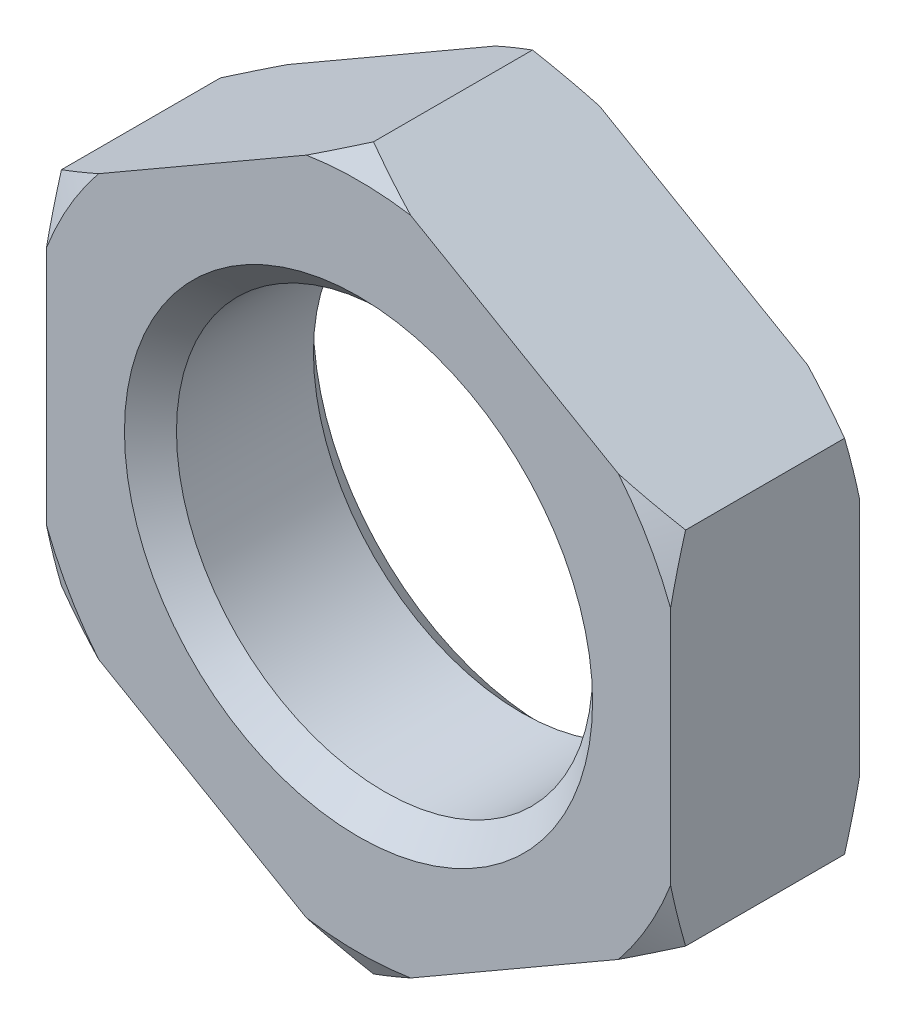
SolidWorks part; units mm, degrees
ref_plane "Front Plane" through (0, 0, 0) normal (0, 0, 1) x (1, 0, 0)
ref_plane "Top Plane" through (0, 0, 0) normal (0, 1, 0) x (1, 0, 0)
ref_plane "Right Plane" through (0, 0, 0) normal (1, 0, 0) x (0, 0, -1)
sketch "Sketch1" plane through (0, 0, 0) normal (0, 0, 1) x (1, 0, 0)
  line L1 (0, 20.7846) -> (-18, 10.3923)
  line L2 (-18, 10.3923) -> (-18, -10.3923)
  line L3 (-18, -10.3923) -> (0, -20.7846)
  line L4 (0, -20.7846) -> (18, -10.3923)
  line L5 (18, -10.3923) -> (18, 10.3923)
  line L6 (18, 10.3923) -> (0, 20.7846)
  circle A0 centre (0, 0) radius 18 construction
  circle A1 centre (0, 0) radius 12
  dimension "D2" = 24
  dimension "D1" = 36
extrude "Boss-Extrude1" add sketch "Sketch1" along normal mid plane 10.9
sketch "Sketch2" plane through (0, 0, 0) normal (1, 0, 0) x (0, 0, -1)
  line L0 (7.477, 0) -> (-8.5759, 0) construction
sketch "Sketch3" plane through (0, 0, 0) normal (1, 0, 0) x (0, 0, -1)
  line L0 (-5.45, 20.7846) -> (-5.45, 19.2846)
  line L1 (-5.45, 10.3923) -> (-5.45, 20.7846) construction
  line L2 (-5.45, 19.2846) -> (-4.584, 20.7846)
  line L3 (-5.45, 20.7846) -> (5.45, 20.7846) construction
  line L4 (-4.584, 20.7846) -> (-5.45, 20.7846)
  dimension "D1" = 1.5
  dimension "D2" = 30
revolve "Cut-Revolve1" cut sketch "Sketch3" angle 360 about L0
mirror "Mirror1" about plane through (0, 0, 0) normal (0, 0, 1) of "Cut-Revolve1"
chamfer "Chamfer1" distance 1.5 angle 45 2 edges at (12, 0, -5.45) (12, 0, 5.45)
